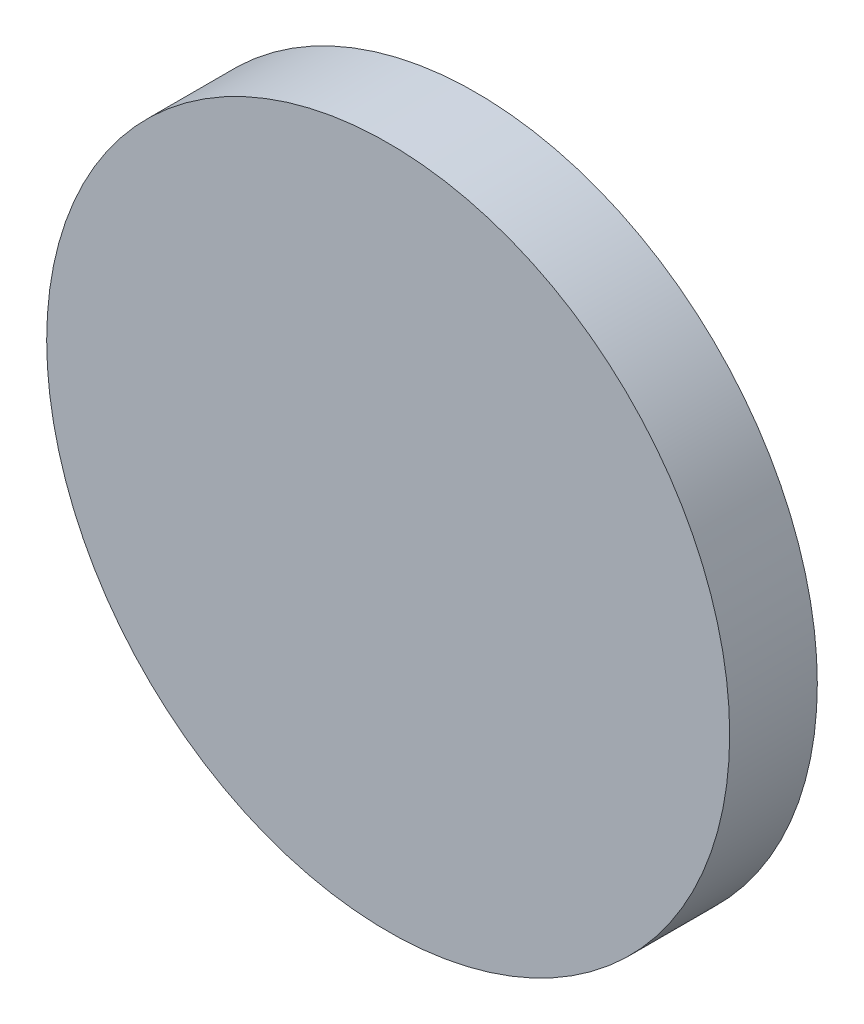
SolidWorks part; units mm, degrees
ref_plane "Front Plane" through (0, 0, 0) normal (0, 0, 1) x (1, 0, 0)
ref_plane "Top Plane" through (0, 0, 0) normal (0, 1, 0) x (1, 0, 0)
ref_plane "Right Plane" through (0, 0, 0) normal (1, 0, 0) x (0, 0, -1)
sketch "Sketch1" plane through (0, 0, 0) normal (0, 0, 1) x (1, 0, 0)
  circle A0 centre (0, 0) radius 9.8974
extrude "Extrude1" add sketch "Sketch1" along normal blind 2.54
sketch "Sketch2" plane through (0, 0, 0) normal (1, 0, 0) x (0, 0, -1)
  line L0 (0, 0) -> (400, 0)
  line L1 (400, 0) -> (594.8557, -112.5)
  line L2 (594.8557, -112.5) -> (870.6317, -343.9035)
  dimension "D1" = 150
  dimension "D2" = 170
  dimension "D3" = 400
  dimension "D4" = 225
  dimension "D5" = 360
sketch "Sketch3" plane through (0, 0, 0) normal (0, 1, 0) x (1, 0, 0)
  line L0 (9.8974, -2.54) -> (-9.8974, -2.54)
